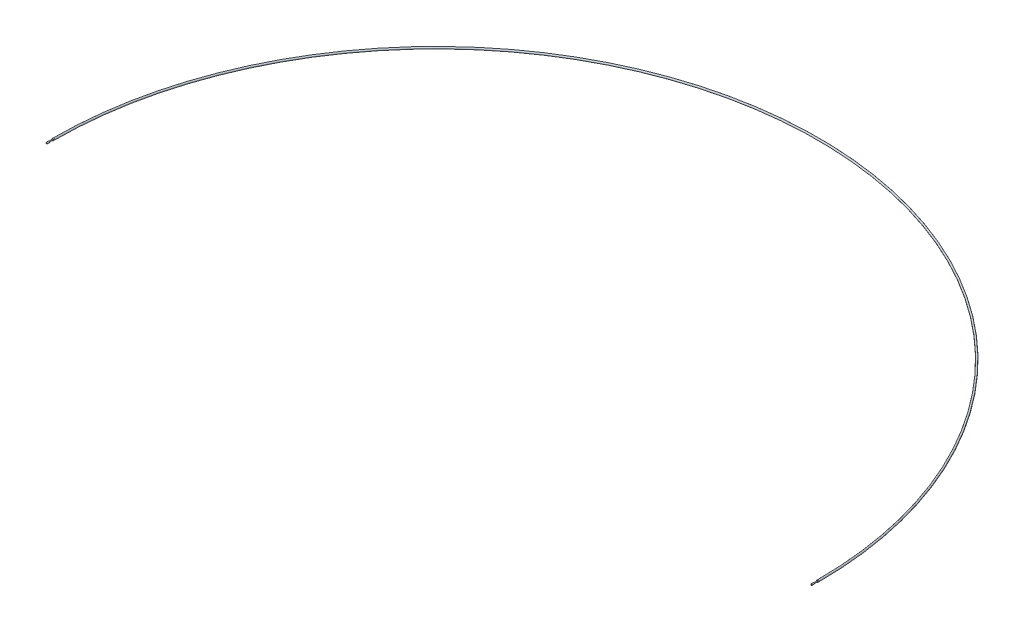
SolidWorks part; units mm, degrees
ref_plane "Front Plane" through (0, 0, 0) normal (0, 0, 1) x (1, 0, 0)
ref_plane "Top Plane" through (0, 0, 0) normal (0, 1, 0) x (1, 0, 0)
ref_plane "Right Plane" through (0, 0, 0) normal (1, 0, 0) x (0, 0, -1)
sketch "Sketch1" plane through (0, 0, 0) normal (0, 1, 0) x (1, 0, 0)
  arc A0 (0, 0) -> (2716.5839, 0) centre (1358.2919, 0) cw
  dimension "D1" = 4267.2
sketch "Sketch2" plane through (0, 0, 0) normal (0, 0, 1) x (1, 0, 0)
  circle A0 centre (0, 0) radius 3.175
  circle A1 centre (0, 0) radius 2.3812
  dimension "D1" = 6.35
  dimension "D2" = 0.7937
sweep "Sweep1" add profiles "Sketch2" path "Sketch1"
sketch "Sketch9" plane through (0, 0, 0) normal (0, 0, 1) x (1, 0, 0)
  circle A0 centre (0, 0) radius 3.175
extrude "Boss-Extrude1" add sketch "Sketch9" along normal blind 3.81
sketch "Sketch10" plane through (0, 0, 3.81) normal (0, 0, 1) x (1, 0, 0)
  circle A0 centre (0, 0) radius 1.5875
  dimension "D1" = 3.175
extrude "Boss-Extrude2" add sketch "Sketch10" along normal blind 12.7
sketch "Sketch11" plane through (0, 0, 16.51) normal (0, 0, 1) x (1, 0, 0)
  circle A0 centre (0, 0) radius 2.3813
  dimension "D1" = 4.7625
extrude "Boss-Extrude3" add sketch "Sketch11" along normal blind 8.89
sketch "Sketch12" plane through (0, 0, 0) normal (0, 0, 1) x (1, 0, 0)
  line L0 (2716.5839, 0) -> (0, 0) construction
  circle A0 centre (2716.5839, 0) radius 3.175
extrude "Boss-Extrude4" add sketch "Sketch12" along normal blind 3.81
sketch "Sketch13" plane through (0, 0, 3.81) normal (0, 0, 1) x (1, 0, 0)
  circle A0 centre (2716.5839, 0) radius 1.5875
  dimension "D1" = 3.175
extrude "Boss-Extrude5" add sketch "Sketch13" along normal blind 12.7
sketch "Sketch14" plane through (0, 0, 16.51) normal (0, 0, 1) x (1, 0, 0)
  circle A0 centre (2716.5839, 0) radius 2.3812
  dimension "D1" = 4.7625
extrude "Boss-Extrude6" add sketch "Sketch14" along normal blind 8.89
chamfer "Chamfer1" distance 0.635 angle 45 4 edges at (2.3813, 0, 16.51) (2.3813, 0, 25.4) (2718.9651, 0, 16.51) (2718.9651, 0, 25.4)
